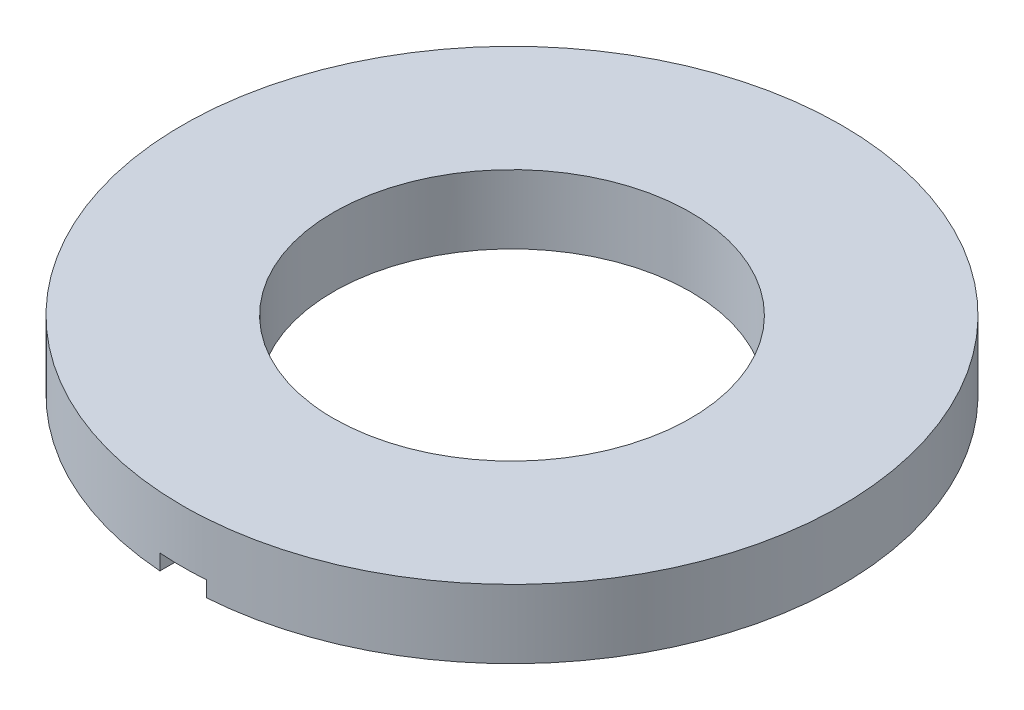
SolidWorks part; units mm, degrees
ref_plane "Front Plane" through (0, 0, 0) normal (0, 0, 1) x (1, 0, 0)
ref_plane "Top Plane" through (0, 0, 0) normal (0, 1, 0) x (1, 0, 0)
ref_plane "Right Plane" through (0, 0, 0) normal (1, 0, 0) x (0, 0, -1)
sketch "Sketch1" plane through (0, 0, 0) normal (0, 1, 0) x (1, 0, 0)
  circle A0 centre (0, 0) radius 6.5
  circle A1 centre (0, 0) radius 12
  dimension "D1" = 13
  dimension "D2" = 24
extrude "Extrude1" add sketch "Sketch1" along normal blind 2.5
sketch "Sketch2" plane through (0, 0, 0) normal (0, -1, 0) x (1, 0, 0)
  line L1 (-0.85, 1) -> (0.85, 1)
  line L2 (-0.85, 1) -> (-0.85, 12)
  line L3 (-0.85, 12) -> (0.85, 12)
  line L4 (0.85, 1) -> (0.85, 12)
  line L5 (-0.85, 1) -> (0.85, 12) construction
  line L6 (-0.85, 12) -> (0.85, 1) construction
  circle A0 centre (0, 0) radius 6.5 construction
  circle A1 centre (0, 0) radius 12 construction
  point P0 (0, 6.5)
  dimension "D1" = 1.7
extrude "Cut-Extrude1" cut sketch "Sketch2" against normal blind 0.5667
